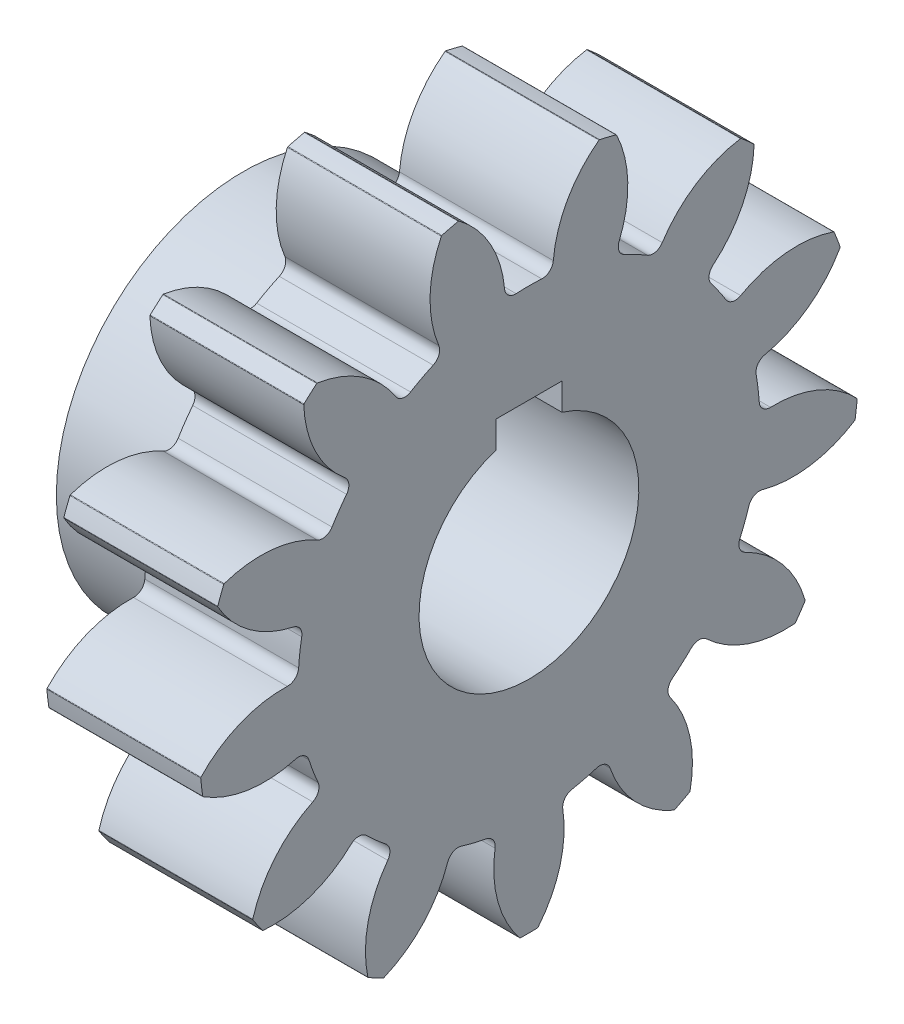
SolidWorks part; units mm, degrees
ref_plane "Plane1" through (0, 0, 0) normal (0, 0, 1) x (1, 0, 0)
ref_plane "Plane2" through (0, 0, 0) normal (0, 1, 0) x (1, 0, 0)
ref_plane "Plane3" through (0, 0, 0) normal (1, 0, 0) x (0, 0, -1)
sketch "HoldingSke" plane through (0, 0, 0) normal (0, 1, 0) x (1, 0, 0)
  line L0 (0, 0) -> (0.4872, -0.1125)
  line L1 (-15, 0) -> (100, 0) construction
  line L2 (0, 0) -> (-2.1039, 2.3779)
  line L3 (0, 0) -> (-11.863, 4.5341)
  line L4 (0, 0) -> (8.4147, 1.9427)
  line L5 (0, 0) -> (-46.8476, -17.4728)
  line L6 (0, 0) -> (-5.8027, -3.9151)
  line L7 (-2.1039, 2.3779) -> (8.6586, 51.2059)
  line L8 (-76.2, 54.61) -> (-76.1, 54.61)
  line L9 (-71.009, 38.7566) -> (-53.1078, 45.2721)
  line L10 (-76.2, 71.12) -> (104.1128, 71.12)
  line L11 (0, 0) -> (-7, 0)
  line L12 (-76.2, 101.6) -> (-76.133, 101.6)
  line L13 (24.9733, 27.94) -> (52.9518, 28.4284)
  line L14 (24.9733, 27.94) -> (24.9743, 27.94)
  line L15 (24.9733, 27.94) -> (100.4006, 29.5858)
  line L16 (-63.627, -2) -> (-12.827, -2)
  circle A0 centre (0, 0) radius 0.4
  circle A1 centre (0, 0) radius 10.499
  circle A2 centre (0, 0) radius 37.5
  circle A3 centre (0, 0) radius 0.4
  dimension "MHD" = 20.998
  dimension "Hub_dia" = 75
  dimension "Bore" = 0.8
  dimension "MBD" = 0.8
  dimension "Num_teeth" = 13
  dimension "Pitch_radius" = 180.3128
  dimension "Pitch" = 0.5
  dimension "Width" = 7
  dimension "Overall_len" = 50
  dimension "Show_teeth" = 13
  dimension "Thickness" = 7
  dimension "OAL" = 50.0001
  dimension "T_dim" = 0.1
  dimension "Ap" = 20
  dimension "H" = 19.05
  dimension "Backlash" = 0.067
  dimension "Addendum_fac" = 1
  dimension "Dedendum_fac" = 1.25
  dimension "Clearance_fac" = 0.25
  dimension "Dedendum_add" = 0.001
  dimension "Module" = 2
sketch "BasProSke" plane through (0, 0, 0) normal (0, 1, 0) x (1, 0, 0)
  line L0 (-10, 0) -> (60, 0) construction
  line L1 (0, 0) -> (0, 15)
  line L2 (0, 0) -> (7, 0)
  line L3 (7, 0) -> (7, 15)
  line L4 (7, 15) -> (0, 15)
  dimension "Diameter" = 30
  dimension "Thickness" = 7
revolve "Base-Revolve" add sketch "BasProSke" angle 360 about L0
sketch "TooCutSke" plane through (0, 0, 0) normal (1, 0, 0) x (0, 0, -1)
  line L1 (0, 0) -> (0, 107) construction
  line L2 (0, 0) -> (-1.6841, 12.8905) construction
  line L3 (0, 0) -> (-6.1834, 25.087) construction
  line L4 (-1.6841, 12.8905) -> (-3.0917, 12.5435) construction
  arc A0 (1.0882, 10.4424) -> (-1.0882, 10.4424) centre (0, 0) ccw
  arc A1 (3.2249, 14.6752) -> (-3.2249, 14.6752) centre (0, 0) ccw
  circle A2 centre (0, 0) radius 13 construction
  circle A3 centre (0, 0) radius 12.216 construction
  arc A4 (-1.0882, 10.4424) -> (-3.2249, 14.6752) centre (-6.2882, 10.4733) ccw
  arc A5 (3.2249, 14.6752) -> (1.0882, 10.4424) centre (6.2882, 10.4733) ccw
  dimension "Root_dia" = 20.998
  dimension "Overcut_dia" = 30.0508
  dimension "Pitch_dia" = 26
  dimension "Base_dia" = 24.432
  dimension "Flank_rad" = 5.2
  dimension "Half_ang" = 13.846
  dimension "Half_CT" = 1.4497
extrude "ToothCut" cut sketch "TooCutSke" along normal through all
fillet "Breaks" radius 0.04 2 edges at (3.5, 14.6552, -3.1976) (3.5, 14.6552, 3.1976)
fillet "RootFillets" radius 0.501 2 edges at (3.5, 10.4424, -1.0882) (3.5, 10.4424, 1.0882)
pattern_circular "TeethCuts" count 13 every 27.692 about axis through (-10, 0, 0) along (1, 0, 0) of "ToothCut", "RootFillets", "Breaks"
sketch "HubNeaOneSke" plane through (0, 0, 0) normal (-1, 0, 0) x (0, 0, 1)
  circle A0 centre (0, 0) radius 10.499
  dimension "Diameter" = 20.998
extrude "HubNearOne" [suppressed] add sketch "HubNeaOneSke" along normal blind 43.0001
sketch "HubNeaBotSke" plane through (0, 0, 0) normal (-1, 0, 0) x (0, 0, 1)
  circle A0 centre (0, 0) radius 10.499
  dimension "Diameter" = 20.998
extrude "HubNearBoth" [suppressed] add sketch "HubNeaBotSke" along normal blind 21.5
ref_plane "FarPln" through (7, 0, 0) normal (1, 0, 0) x (0, 0, -1)
sketch "HubFarSke" plane through (7, 0, 0) normal (1, 0, 0) x (0, 0, -1)
  circle A0 centre (0, 0) radius 10.499
  dimension "Diameter" = 20.998
extrude "HubFar" [suppressed] add sketch "HubFarSke" along normal blind 21.5
sketch "BorSke" plane through (0, 0, 0) normal (1, 0, 0) x (0, 0, -1)
  circle A0 centre (0, 0) radius 0.4
  dimension "Diameter" = 0.8
extrude "Bore" cut sketch "BorSke" along normal mid plane 100.0001
sketch "KeySke" plane through (0, 0, 0) normal (1, 0, 0) x (0, 0, -1)
  line L0 (-0.05, 0) -> (-0.05, 0.5)
  line L1 (-0.05, 0.5) -> (0.05, 0.5)
  line L2 (0.05, 0.5) -> (0.05, 0)
  line L3 (0, 0) -> (0, 34) construction
  line L4 (-0.05, 0) -> (0.05, 0)
  dimension "Offset" = 0.5
  dimension "Width" = 0.1
extrude "Keyway" [suppressed] cut sketch "KeySke" along normal mid plane 100.0001
pattern_circular "Keyway2" [suppressed] count 2 every 90 about axis through (-10, 0, 0) along (1, 0, 0)
sketch "草图1" plane through (7, 0, 0) normal (1, 0, 0) x (0, 0, -1)
  line L0 (0, 5.8095) -> (0, 8) construction
  line L1 (1.5, 4.7697) -> (1.5, 6)
  line L2 (-1.5, 4.7697) -> (-1.5, 6)
  line L4 (1.5, 6) -> (-1.5, 6)
  arc A0 (-1.5, 4.7697) -> (1.5, 4.7697) centre (0, 0) ccw
  circle A1 centre (0, 0) radius 15 construction
  dimension "D1" = 5
  dimension "D2" = 1.5
  dimension "D3" = 6
extrude "切除-拉伸1" cut sketch "草图1" against normal through all
sketch "草图2" plane through (0, 0, 0) normal (-1, 0, 0) x (0, 0, 1)
  line L0 (1.5, 6) -> (1.5, 4.7697) construction
  line L1 (-1.5, 4.7697) -> (-1.5, 6) construction
  line L2 (-1.5, 6) -> (1.5, 6) construction
  line L3 (1.5, 6) -> (1.5, 4.7697)
  line L4 (-1.5, 4.7697) -> (-1.5, 6)
  line L5 (-1.5, 6) -> (1.5, 6)
  arc A0 (-1.5, 4.7697) -> (1.5, 4.7697) centre (0, 0) ccw
  circle A1 centre (0, 0) radius 8.5
  dimension "D1" = 17
extrude "拉伸1" add sketch "草图2" along normal blind 6
equation "' \"Module@HoldingSke\" = 6.35"
equation "' \"Num_teeth@HoldingSke\" = 12"
equation "' \"Ap@HoldingSke\" =  20"
equation "' \"Width@HoldingSke\" = 0.5 * 25.4"
equation "' \"Hub_dia@HoldingSke\"= 1 * 25.4"
equation "' \"Overall_len@HoldingSke\" = 1.0 * 25.4"
equation "' \"Bore@HoldingSke\" = 0.75 * 25.4"
equation "' \"T_dim@HoldingSke\" = 0.1 * 25.4"
equation "' \"Width@KeySke\" = 0.25 * 25.4"
equation "' \"Show_teeth@HoldingSke\" = 13"
equation "' \"Backlash@HoldingSke\" = 0.009 * 25.4"
equation "' \"Addendum_fac@HoldingSke\" = 1.0"
equation "' \"Dedendum_fac@HoldingSke\" = 1.25"
equation "' \"Dedendum_add@HoldingSke\" = 0.00005 * 25.4"
equation "' \"Clearance_fac@HoldingSke\" = 0.25"
equation "\"Pitch@HoldingSke\" = 1 / \"Module@HoldingSke\""
equation "\"Overcut_dia@TooCutSke\" = (\"Num_teeth@HoldingSke\" + 2 * \"Addendum_fac@HoldingSke\") / \"Pitch@HoldingSke\" + 0.002 * 25.4"
equation "\"Pitch_dia@TooCutSke\" = \"Num_teeth@HoldingSke\" / \"Pitch@HoldingSke\""
equation "\"Base_dia@TooCutSke\" = \"Num_teeth@HoldingSke\" / \"Pitch@HoldingSke\" * cos((\"Ap@HoldingSke\"  * 3.14159265 / 180))"
equation "\"Root_dia@TooCutSke\" = (\"Num_teeth@HoldingSke\" + 2) / \"Pitch@HoldingSke\" - 2 * (\"Addendum_fac@HoldingSke\" + \"Dedendum_fac@HoldingSke\") / \"Pitch@HoldingSke\" - \"Dedendum_add@HoldingSke\" * 2"
equation "\"Half_ang@TooCutSke\" = 180 / \"Num_teeth@HoldingSke\""
equation "\"Half_CT@TooCutSke\" = \"Num_teeth@HoldingSke\" / \"Pitch@HoldingSke\" * sin((3.14159265 / 2 / \"Num_teeth@HoldingSke\")) / 2 - 7 * \"Backlash@HoldingSke\" / 4"
equation "\"Flank_rad@TooCutSke\" = \"Num_teeth@HoldingSke\" / \"Pitch@HoldingSke\" / 5"
equation "\"Radius@RootFillets\" = \"Clearance_fac@HoldingSke\" / \"Pitch@HoldingSke\" + \"Dedendum_add@HoldingSke\""
equation "\"Break_rad@Breaks\" = 0.02 / \"Pitch@HoldingSke\""
equation "\"Thickness@HoldingSke\" = \"Width@HoldingSke\""
equation "\"OAL@HoldingSke\" = \"Thickness@HoldingSke\""
equation "\"MHD@HoldingSke\" = (\"Num_teeth@HoldingSke\" + 2) / \"Pitch@HoldingSke\" - 2 * (\"Addendum_fac@HoldingSke\" + \"Dedendum_fac@HoldingSke\")  / \"Pitch@HoldingSke\" - \"Dedendum_add@HoldingSke\" * 2"
equation "\"MBD@HoldingSke\" = (\"Num_teeth@HoldingSke\" + 2) / \"Pitch@HoldingSke\" - 2 * (\"Addendum_fac@HoldingSke\" + \"Dedendum_fac@HoldingSke\")  / \"Pitch@HoldingSke\" - \"Dedendum_add@HoldingSke\" * 2 - 0.002 * 25.4"
equation "\"MHD@HoldingSke\" = ((sgn( \"MHD@HoldingSke\" - \"Hub_dia@HoldingSke\" )-1)*( \"MHD@HoldingSke\" - \"Hub_dia@HoldingSke\" ))/-2+ \"Hub_dia@HoldingSke\""
equation "\"MBD@HoldingSke\" = ((sgn( \"MBD@HoldingSke\" - \"Bore@HoldingSke\" )-1)*( \"MBD@HoldingSke\" - \"Bore@HoldingSke\" ))/-2+ \"Bore@HoldingSke\""
equation "\"OAL@HoldingSke\" = ((sgn( \"OAL@HoldingSke\" - \"Overall_len@HoldingSke\" )+1)*( \"OAL@HoldingSke\" - \"Overall_len@HoldingSke\" ))/2 + \"Overall_len@HoldingSke\" + 0.000002 * 25.4"
equation "\"Num_teeth@TeethCuts\" = int( \"Show_teeth@HoldingSke\" ) + 1"
equation "\"Num_teeth@TeethCuts\" = ((sgn( \"Num_teeth@TeethCuts\" - \"Num_teeth@HoldingSke\" )-1)*( \"Num_teeth@TeethCuts\" - \"Num_teeth@HoldingSke\" ))/-2+ \"Num_teeth@HoldingSke\""
equation "\"Num_teeth@TeethCuts\" = ((sgn( \"Num_teeth@TeethCuts\" - 2.0)+1)*( \"Num_teeth@TeethCuts\" - 2.0))/2 +2.0"
equation "\"Angle@TeethCuts\" = 360.0 / \"Num_teeth@HoldingSke\""
equation "\"Diameter@BasProSke\" = (\"Num_teeth@HoldingSke\" + 2 * \"Addendum_fac@HoldingSke\") / \"Pitch@HoldingSke\""
equation "\"Thickness@BasProSke\"  = \"Thickness@HoldingSke\""
equation "' \"Fillet_rad@BasProSke\" =  \"Thickness@HoldingSke\" * 0.05"
equation "\"MHD@HoldingSke\" = ((sgn( \"MHD@HoldingSke\" - \"Root_dia@TooCutSke\" )-1)*( \"MHD@HoldingSke\" - \"Root_dia@TooCutSke\" ))/-2+ \"Root_dia@TooCutSke\""
equation "\"Diameter@HubNeaOneSke\" = \"MHD@HoldingSke\""
equation "\"Length@HubNearOne\" = \"OAL@HoldingSke\" - \"Thickness@BasProSke\""
equation "\"Diameter@HubNeaBotSke\" = \"MHD@HoldingSke\""
equation "\"Length@HubNearBoth\" = ( \"OAL@HoldingSke\" - \"Thickness@BasProSke\" ) / 2.0"
equation "\"Thickness@FarPln\" = \"Thickness@BasProSke\""
equation "\"Diameter@HubFarSke\" = \"MHD@HoldingSke\""
equation "\"Length@HubFar\" = ( \"OAL@HoldingSke\" - \"Thickness@BasProSke\" ) / 2.0"
equation "\"Diameter@BorSke\" = \"MBD@HoldingSke\""
equation "\"D1@Bore\" = \"OAL@HoldingSke\" * 2.0"
equation "\"D1@Keyway\" = \"OAL@HoldingSke\" * 2.0"
equation "\"Offset@KeySke\" = \"T_dim@HoldingSke\" + \"MBD@HoldingSke\" / 2.0"
